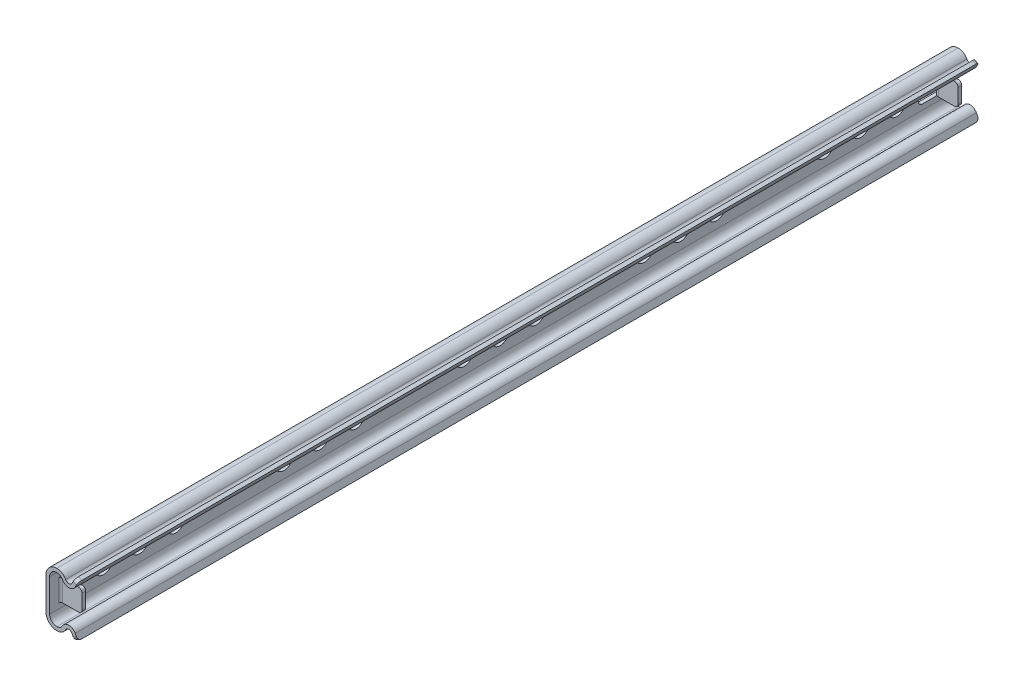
SolidWorks part; units mm, degrees
ref_plane "Front Plane" through (0, 0, 0) normal (0, 0, 1) x (1, 0, 0)
ref_plane "Top Plane" through (0, 0, 0) normal (0, 1, 0) x (1, 0, 0)
ref_plane "Right Plane" through (0, 0, 0) normal (1, 0, 0) x (0, 0, -1)
sketch "Sketch1" plane through (0, 0, 0) normal (0, 0, 1) x (1, 0, 0)
  line L0 (-4, -4.5) -> (4, -4.5) construction
  line L1 (-1, -7.5) -> (4, -7.5) construction
  line L2 (-4, -4.5) -> (-4, 4.5)
  line L3 (-1, 7.5) -> (4, 7.5) construction
  line L4 (4, -7.5) -> (4, 7.5) construction
  line L5 (-4, -7.5) -> (4, 7.5) construction
  line L6 (-4, 7.5) -> (4, -7.5) construction
  line L7 (3.2157, -6.0294) -> (4, -7.5)
  line L8 (0, 0) -> (-4, 0) construction
  line L9 (3.2157, 6.0294) -> (4, 7.5)
  line L10 (-3, -4.5) -> (-3, 4.5)
  line L11 (3, 4.6144) -> (3, 4.6144)
  line L12 (4.8824, -7.0294) -> (4.098, -5.5588)
  line L13 (3, -4.6144) -> (3, -4.6144)
  line L14 (4, -7.5) -> (4.8824, -7.0294)
  line L15 (4.098, 5.5588) -> (4.8824, 7.0294)
  line L16 (4, 7.5) -> (4.8824, 7.0294)
  line L17 (4.8824, 7.0294) -> (3, 4.6144) construction
  line L18 (3, -4.6144) -> (3, 4.6144) construction
  arc A0 (-1, -7.5) -> (-4, -4.5) centre (-1, -4.5) cw
  arc A1 (-4, 4.5) -> (-1, 7.5) centre (-1, 4.5) cw
  arc A2 (-1, -7.5) -> (1.451, -6.0294) centre (-1, -4.7222) ccw
  arc A3 (1.451, -6.0294) -> (3.2157, -6.0294) centre (2.3333, -6.5) cw
  arc A4 (1.451, 6.0294) -> (3.2157, 6.0294) centre (2.3333, 6.5) ccw
  arc A5 (-1, 7.5) -> (1.451, 6.0294) centre (-1, 4.7222) cw
  arc A6 (-3, 4.5) -> (-1, 6.5) centre (-1, 4.5) cw
  arc A7 (-1, 6.5) -> (0.5686, 5.5588) centre (-1, 4.7222) cw
  arc A8 (0.5686, 5.5588) -> (3, 4.6144) centre (2.3333, 6.5) ccw
  arc A9 (0.5686, -5.5588) -> (3, -4.6144) centre (2.3333, -6.5) cw
  arc A10 (-1, -6.5) -> (0.5686, -5.5588) centre (-1, -4.7222) ccw
  arc A11 (-1, -6.5) -> (-3, -4.5) centre (-1, -4.5) cw
  arc A12 (4.098, -5.5588) -> (3, -4.6144) centre (2.3333, -6.5) ccw
  arc A13 (4.098, 5.5588) -> (3, 4.6144) centre (2.3333, 6.5) cw
  point P0 (0, 0)
  dimension "D3" = 3
  dimension "D4" = 1
  dimension "D1" = 15
  dimension "D2" = 8
  dimension "D6" = 1
  dimension "D5" = 1
extrude "Boss-Extrude1" add sketch "Sketch1" along normal mid plane 250 contours A13 L15 L16 L9 A4 A5 A1 L2 A0 A2 A3 L7 L14 L12 A12 L13 A9 A10 A11 L10 A6 A7 A8
sketch "Sketch2" plane through (-3, 0, 0) normal (1, 0, 0) x (0, 0, -1)
  line L0 (-125, 0) -> (-110, 0) construction
  line L1 (-125, -4.5) -> (-125, 4.5) construction
  line L2 (-110, 0) -> (-100, 0) construction
  line L3 (-100, 0) -> (-90, 0) construction
  circle A0 centre (-110, 0) radius 2.5
  circle A1 centre (-100, 0) radius 2.5
  circle A2 centre (-90, 0) radius 2.5
  circle A3 centre (-60, 0) radius 2.5
  circle A4 centre (-50, 0) radius 2.5
  circle A5 centre (-40, 0) radius 2.5
  circle A6 centre (-10, 0) radius 2.5
  circle A7 centre (0, 0) radius 2.5
  circle A8 centre (10, 0) radius 2.5
  circle A9 centre (40, 0) radius 2.5
  circle A10 centre (50, 0) radius 2.5
  circle A11 centre (60, 0) radius 2.5
  circle A12 centre (90, 0) radius 2.5
  circle A13 centre (100, 0) radius 2.5
  circle A14 centre (110, 0) radius 2.5
  dimension "D3" = 5
  dimension "D4" = 20
  dimension "D5" = 50
  dimension "D1" = 3
  dimension "D2" = 5
extrude "Cut-Extrude1" cut sketch "Sketch2" against normal blind 250
sketch "Sketch3" plane through (-3, 0, 0) normal (1, 0, 0) x (0, 0, -1)
  line L0 (-125, 0) -> (-119, 0) construction
  line L1 (-122, -3) -> (-116, -3)
  line L2 (-122, -3) -> (-122, 3)
  line L3 (-122, 3) -> (-116, 3)
  line L4 (-116, -3) -> (-116, 3)
  line L5 (-122, -3) -> (-116, 3) construction
  line L6 (-122, 3) -> (-116, -3) construction
  line L7 (-125, -4.5) -> (-125, 4.5) construction
  point P0 (-119, 0)
  dimension "D1" = 6
  dimension "D2" = 6
  dimension "D3" = 6
extrude "Cut-Extrude2" cut sketch "Sketch3" against normal blind 10
sketch "Sketch4" plane through (0, 0, 0) normal (0, 1, 0) x (1, 0, 0)
  line L0 (-3, -122) -> (3, -122)
  line L1 (3, -122) -> (3, -121)
  line L2 (3, -121) -> (-4, -121)
  line L3 (-4, -121) -> (-4, -122)
  line L4 (-4, -122) -> (-3, -122)
  dimension "D1" = 6
  dimension "D2" = 1
extrude "Boss-Extrude2" add sketch "Sketch4" along normal mid plane 6
fillet "Fillet1" radius 0.6 1 edges at (-3, 0, 122)
fillet "Fillet2" radius 1.6 1 edges at (-4, 0, 121)
mirror "Mirror1" about plane through (0, 0, 0) normal (0, 0, 1) of "Fillet2", "Fillet1", "Boss-Extrude2", "Cut-Extrude2"
fillet "Fillet3" radius 1 12 edges at (-3.5, 3, -116) (-3.5, -3, -116) (3, -3, -121.5) (3, 3, -121.5) (4.4412, 7.2647, -125) (4.4412, -7.2647, -125) (4.4412, 7.2647, 125) (4.4412, -7.2647, 125) (-3.5, -3, 116) (-3.5, 3, 116) (3, 3, 121.5) (3, -3, 121.5)
